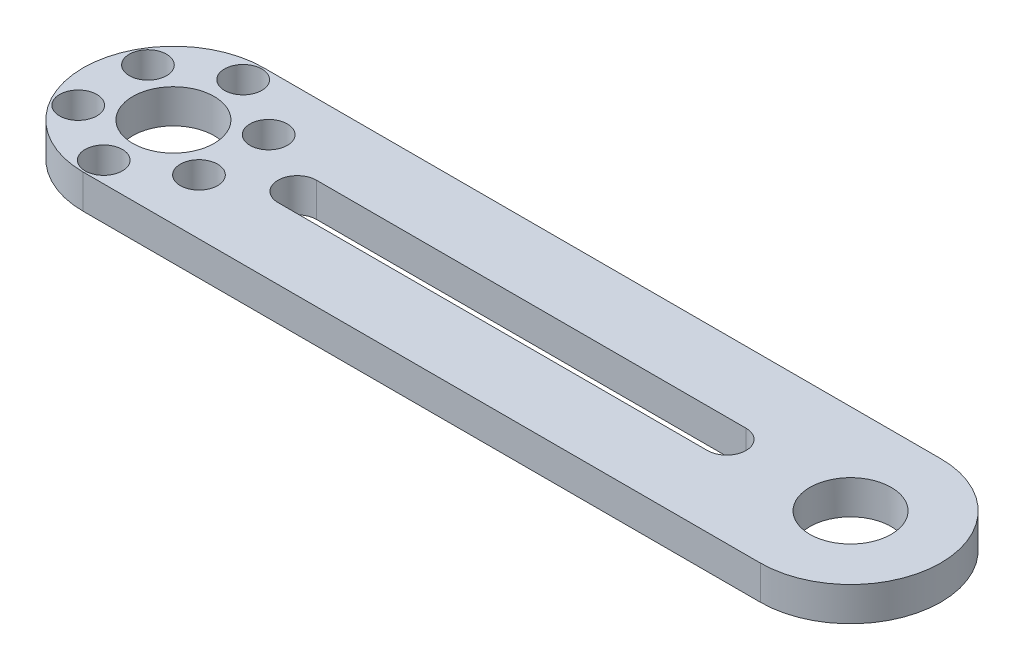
SolidWorks part; units mm, degrees
ref_plane "Front Plane" through (0, 0, 0) normal (0, 0, 1) x (1, 0, 0)
ref_plane "Top Plane" through (0, 0, 0) normal (0, 1, 0) x (1, 0, 0)
ref_plane "Right Plane" through (0, 0, 0) normal (1, 0, 0) x (0, 0, -1)
sketch "Sketch1" plane through (0, 0, 0) normal (0, 1, 0) x (1, 0, 0)
  line L0 (51, 0) -> (-51, 0) construction
  line L3 (32.35, 0) -> (-32.35, 0) construction
  line L4 (32.35, -2.91) -> (-32.35, -2.91)
  line L5 (32.35, 2.91) -> (-32.35, 2.91)
  line L6 (51, -13.6) -> (-51, -13.6)
  line L7 (51, 13.6) -> (-51, 13.6)
  arc A2 (32.35, -2.91) -> (32.35, 2.91) centre (32.35, 0) ccw
  arc A3 (-32.35, 2.91) -> (-32.35, -2.91) centre (-32.35, 0) ccw
  arc A4 (51, -13.6) -> (51, 13.6) centre (51, 0) ccw
  arc A5 (-51, 13.6) -> (-51, -13.6) centre (-51, 0) ccw
  point P2 (0, 0)
  point P10 (0, 0)
  point P26 (-51, 0)
  dimension "D2" = 2.91
  dimension "D4" = 13.6
  dimension "D1" = 64.7
  dimension "D3" = 102
extrude "Boss-Extrude1" add sketch "Sketch1" along normal mid plane 5.12 contours L7 A5 L6 A4 | L5 A3 L4 A2
sketch "Sketch2" plane through (0, 2.56, 0) normal (0, 1, 0) x (1, 0, 0)
  line L0 (-51, -13.6) -> (-51, 0) construction
  line L1 (-51, 0) -> (-51, 10.5) construction
  line L2 (0, -55) -> (0, 55) construction
  circle A0 centre (-51, 0) radius 6.13
  arc A1 (-51, 13.6) -> (-51, -13.6) centre (-51, 0) ccw construction
  circle A2 centre (-51, 10.5) radius 2.81
  circle A3 centre (-41.9067, 5.25) radius 2.81
  circle A4 centre (-41.9067, -5.25) radius 2.81
  circle A5 centre (-51, -10.5) radius 2.81
  circle A6 centre (-60.0933, -5.25) radius 2.81
  circle A7 centre (-60.0933, 5.25) radius 2.81
  circle A8 centre (51, 0) radius 6.13
  dimension "D1" = 12.26
  dimension "D2" = 5.62
  dimension "D3" = 10.5
  dimension "D4" = 6
extrude "Cut-Extrude1" cut sketch "Sketch2" against normal up to next
